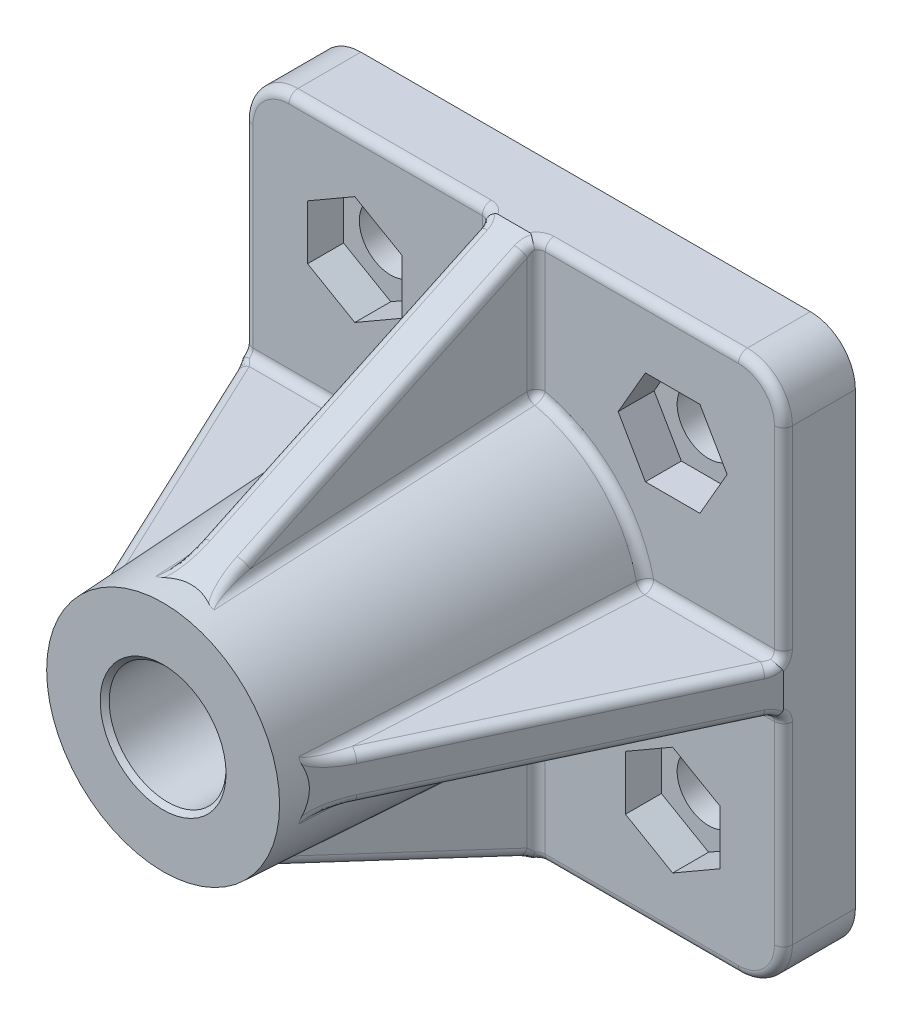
SolidWorks part; units mm, degrees
ref_plane "Plan de face" through (0, 0, 0) normal (0, 0, 1) x (1, 0, 0)
ref_plane "Plan de dessus" through (0, 0, 0) normal (0, 1, 0) x (1, 0, 0)
ref_plane "Plan de droite" through (0, 0, 0) normal (1, 0, 0) x (0, 0, -1)
sketch "Esquisse1" plane through (0, 0, 0) normal (0, 0, 1) x (1, 0, 0)
  line L0 (-30, 30) -> (30, -30) construction
  line L1 (-30, 30) -> (30, 30)
  line L2 (-30, 30) -> (-30, -30)
  line L3 (-30, -30) -> (30, -30)
  line L4 (30, 30) -> (30, -30)
  circle A0 centre (0, 0) radius 6.5
  dimension "D1" = 13
  dimension "D2" = 60
  dimension "D3" = 60
extrude "Boss.-Extru.1" add sketch "Esquisse1" along normal blind 8
sketch "Esquisse2" plane through (0, 0, 8) normal (0, 0, 1) x (1, 0, 0)
  circle A0 centre (0, 0) radius 6.5 construction
  circle A1 centre (0, 0) radius 6.5
  circle A2 centre (0, 0) radius 15
  dimension "D1" = 30
extrude "Boss.-Extru.2" add sketch "Esquisse2" along normal blind 39 draft 3
sketch "Esquisse3" plane through (0, 0, 0) normal (0, 1, 0) x (1, 0, 0)
  line L0 (-30, -8) -> (-11.6396, -8)
  line L1 (-15, -8) -> (15, -8) construction
  line L2 (-11.6396, -8) -> (-11.6396, -47)
  line L3 (-12.9561, -47) -> (12.9561, -47) construction
  line L4 (-11.6396, -47) -> (-30, -8)
extrude "Boss.-Extru.3" add sketch "Esquisse3" along normal mid plane 5
pattern_circular "Répétition circulaire1" count 4 over 360 about axis through (0, 0, 0) along (0, 0, 1) of "Boss.-Extru.3"
fillet "Congé1" radius 5 4 edges at (30, 30, 4) (30, -30, 4) (-30, 30, 4) (-30, -30, 4)
sketch "Esquisse4" plane through (0, 0, 8) normal (0, 0, 1) x (1, 0, 0)
  line L0 (0, 0) -> (28.5355, -28.5355) construction
  arc A0 (25, -30) -> (30, -25) centre (25, -25) ccw construction
  circle A1 centre (17.6777, -17.6777) radius 3.5
  circle A2 centre (0, 0) radius 25 construction
  dimension "D1" = 7
  dimension "D2" = 50
extrude "Enlèv. mat.-Extru.1" cut sketch "Esquisse4" against normal through all
sketch "Esquisse5" plane through (0, 0, 8) normal (0, 0, 1) x (1, 0, 0)
  line L1 (17.6777, -11.6155) -> (12.4277, -14.6466)
  line L2 (12.4277, -14.6466) -> (12.4277, -20.7088)
  line L3 (12.4277, -20.7088) -> (17.6777, -23.7398)
  line L4 (17.6777, -23.7398) -> (22.9277, -20.7088)
  line L5 (22.9277, -20.7088) -> (22.9277, -14.6466)
  line L6 (22.9277, -14.6466) -> (17.6777, -11.6155)
  circle A0 centre (17.6777, -17.6777) radius 5.25 construction
  point P1 (12.4277, -17.6777)
  dimension "D1" = 10.5
extrude "Enlèv. mat.-Extru.2" cut sketch "Esquisse5" against normal blind 4
pattern_circular "Répétition circulaire2" count 4 over 360 about axis through (0, 0, 0) along (0, 0, 1) of "Enlèv. mat.-Extru.2", "Enlèv. mat.-Extru.1"
fillet "Congé2" radius 1 18 edges at (2.5, 22.3951, 8) (10.6066, 10.6066, 8) (-22.3951, -2.5, 8) (-22.3951, 2.5, 8) (10.6066, -10.6066, 8) (2.5, -22.3951, 8) (-2.5, -22.3951, 8) (22.3951, 2.5, 8) (22.3951, -2.5, 8) (-2.5, 22.3951, 8)
fillet "Congé3" radius 1 36 edges at (-2.7929, -29.8621, 8.2929) (-3.0033, -12.7726, 44.5933) (29.8621, 2.7929, 8.2929) (12.829, 2.9249, 44.4736) (29.8621, -2.7929, 8.2929) (12.7726, -3.0033, 44.5933) (2.7929, -29.8621, 8.2929) (2.9249, -12.829, 44.4736) (-29.8621, 2.7929, 8.2929) (-12.7726, 3.0033, 44.5933) (-29.8621, -2.7929, 8.2929) (-12.829, -2.9249, 44.4736) (-2.7929, 29.8621, 8.2929) (-2.9249, 12.829, 44.4736) (2.7929, 29.8621, 8.2929) (3.0033, 12.7726, 44.5933) (-14.25, 30, 8) (-28.5355, 28.5355, 8) (-30, -14.25, 8) (-28.5355, -28.5355, 8) (14.25, 30, 8) (28.5355, 28.5355, 8) (30, -14.25, 8) (28.5355, -28.5355, 8) (-2.5, -21.6419, 25.7537) (21.6419, 2.5, 25.7537) (21.6419, -2.5, 25.7537) (2.5, -21.6419, 25.7537) (-21.6419, 2.5, 25.7537) (-21.6419, -2.5, 25.7537) (-2.5, 21.6419, 25.7537) (2.5, 21.6419, 25.7537) (-30, 14.25, 8) (-14.25, -30, 8) (30, 14.25, 8) (14.25, -30, 8)
chamfer "Chanfrein1" distance 0.5 angle 45 1 edges at (8.5439, 0, 47)
sketch "Esquisse6" plane through (0, 0, 47) normal (0, 0, 1) x (1, 0, 0)
  circle A0 centre (0, 0) radius 9.0439
extrude "Boss.-Extru.4" add sketch "Esquisse6" against normal up to surface (47 mm away)
sketch "Esquisse7" plane through (0, 0, 47) normal (0, 0, 1) x (1, 0, 0)
  circle A0 centre (0, 0) radius 6.5
  dimension "D1" = 13
extrude "Enlèv. mat.-Extru.3" cut sketch "Esquisse7" against normal through all
chamfer "Chanfrein2" distance 0.5 angle 45 1 edges at (6.5, 0, 47)
